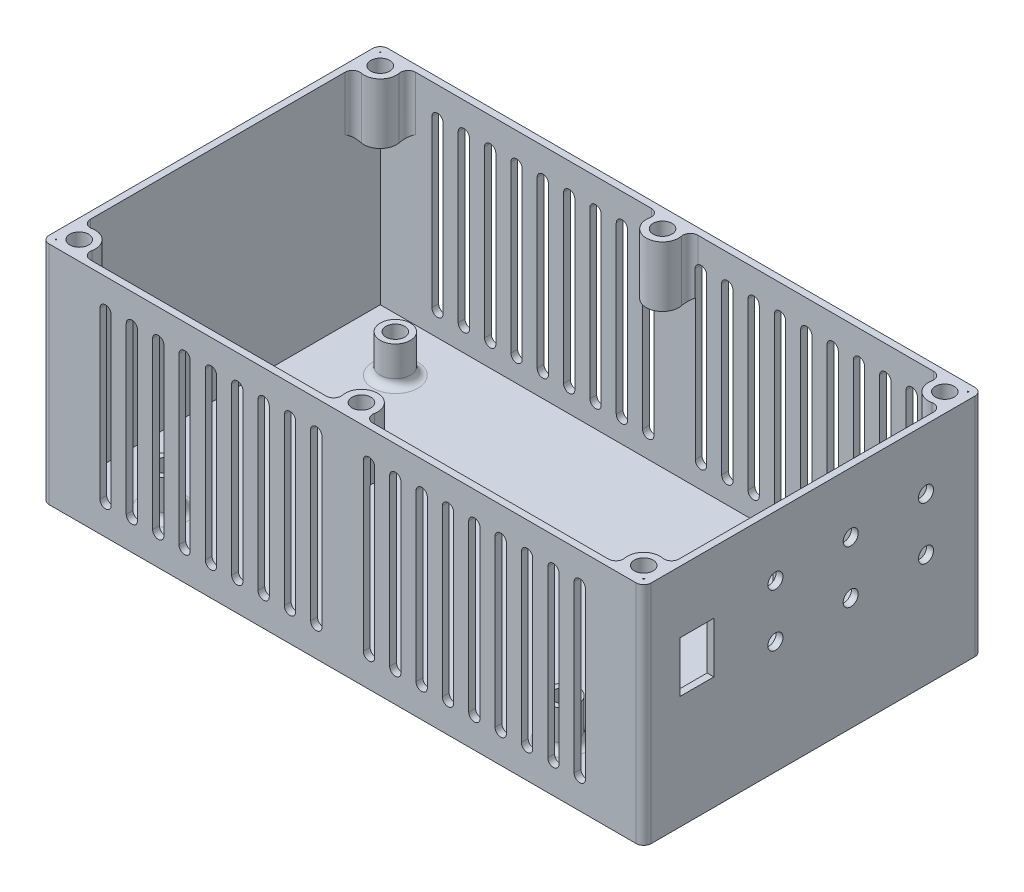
SolidWorks part; units mm, degrees
ref_plane "Front Plane" through (0, 0, 0) normal (0, 0, 1) x (1, 0, 0)
ref_plane "Top Plane" through (0, 0, 0) normal (0, 1, 0) x (1, 0, 0)
ref_plane "Right Plane" through (0, 0, 0) normal (1, 0, 0) x (0, 0, -1)
sketch "Sketch1" plane through (0, 0, 0) normal (0, 1, 0) x (1, 0, 0)
  line L1 (-80, -45) -> (80, -45)
  line L2 (-80, -45) -> (-80, 45)
  line L3 (-80, 45) -> (80, 45)
  line L4 (80, -45) -> (80, 45)
  line L5 (-80, -45) -> (80, 45) construction
  line L6 (-80, 45) -> (80, -45) construction
  point P0 (0, 0)
  dimension "D1" = 160
  dimension "D2" = 90
extrude "Boss-Extrude1" add sketch "Sketch1" along normal blind 60
sketch "Sketch2" plane through (0, 60, 0) normal (0, 1, 0) x (1, 0, 0)
  line L0 (80, 45) -> (-80, 45) construction
  line L1 (-80, 45) -> (-80, -45) construction
  line L2 (80, -45) -> (80, 45) construction
  line L3 (-80, -45) -> (80, -45) construction
  point P0 (-75, 40)
  point P1 (75, 40)
  point P2 (75, -40)
  point P3 (-75, -40)
  point P4 (0, -40)
  point P5 (0, 40)
  dimension "D1" = 5
  dimension "D2" = 5
  dimension "D3" = 5
  dimension "D4" = 5
  dimension "D5" = 5
  dimension "D6" = 5
  dimension "D7" = 5
  dimension "D8" = 5
  dimension "D9" = 5
  dimension "D10" = 5
  dimension "D11" = 80
  dimension "D12" = 80
hole_wizard "Ø4.0mm Dowel Hole1" positions "Sketch3" profile "Sketch5" hole size "Ø4.0" standard "ANSI Metric"
sketch "Sketch3" plane through (0, 60, 0) normal (0, 1, 0) x (1, 0, 0)
  point P0 (-75, 40)
  point P3 (0, 40)
  point P6 (75, 40)
  point P9 (75, -40)
  point P12 (0, -40)
  point P15 (-75, -40)
sketch "Sketch5" plane through (-75, 60, -40) normal (1, 0, 0) x (0, 0, 1)
  line L0 (0, 0) -> (0, 16.5022)
  line L1 (0, 16.5022) -> (2.5, 15)
  line L2 (2.5, 15) -> (2.5, 0)
  line L5 (2.5, 0) -> (0, 0)
  line L10 (0, 16.5022) -> (-2.5, 15) construction
  line L11 (0, -6.35) -> (0, 107.95) construction
  dimension "Hole Dia." = 5
  dimension "Hole Depth" = 15
  dimension "Drill Angle" = 118
shell "Shell1" thickness 1.8
sketch "Sketch7" plane through (0, 0, 45) normal (0, 0, 1) x (1, 0, 0)
  line L3 (-63, 51.9835) -> (-63, 8.0165) construction
  line L6 (-61.5, 51.9835) -> (-61.5, 8.0165)
  line L9 (-64.5, 51.9835) -> (-64.5, 8.0165)
  line L12 (-56, 51.9835) -> (-56, 8.0165) construction
  line L15 (-54.5, 51.9835) -> (-54.5, 8.0165)
  line L18 (-57.5, 51.9835) -> (-57.5, 8.0165)
  line L21 (-49, 51.9835) -> (-49, 8.0165) construction
  line L24 (-47.5, 51.9835) -> (-47.5, 8.0165)
  line L27 (-50.5, 51.9835) -> (-50.5, 8.0165)
  line L30 (-42, 51.9835) -> (-42, 8.0165) construction
  line L33 (-40.5, 51.9835) -> (-40.5, 8.0165)
  line L36 (-43.5, 51.9835) -> (-43.5, 8.0165)
  line L39 (-35, 51.9835) -> (-35, 8.0165) construction
  line L42 (-33.5, 51.9835) -> (-33.5, 8.0165)
  line L48 (-36.5, 51.9835) -> (-36.5, 8.0165)
  line L49 (-28, 51.9835) -> (-28, 8.0165) construction
  line L50 (-26.5, 51.9835) -> (-26.5, 8.0165)
  line L51 (-29.5, 51.9835) -> (-29.5, 8.0165)
  line L52 (-21, 51.9835) -> (-21, 8.0165) construction
  line L53 (-19.5, 51.9835) -> (-19.5, 8.0165)
  line L54 (-22.5, 51.9835) -> (-22.5, 8.0165)
  line L55 (-14, 51.9835) -> (-14, 8.0165) construction
  line L56 (-12.5, 51.9835) -> (-12.5, 8.0165)
  line L57 (-15.5, 51.9835) -> (-15.5, 8.0165)
  line L58 (-7, 51.9835) -> (-7, 8.0165) construction
  line L59 (-5.5, 51.9835) -> (-5.5, 8.0165)
  line L60 (-8.5, 51.9835) -> (-8.5, 8.0165)
  line L64 (7, 51.9835) -> (7, 8.0165) construction
  line L65 (8.5, 51.9835) -> (8.5, 8.0165)
  line L66 (5.5, 51.9835) -> (5.5, 8.0165)
  line L67 (14, 51.9835) -> (14, 8.0165) construction
  line L68 (15.5, 51.9835) -> (15.5, 8.0165)
  line L69 (12.5, 51.9835) -> (12.5, 8.0165)
  line L70 (21, 51.9835) -> (21, 8.0165) construction
  line L71 (22.5, 51.9835) -> (22.5, 8.0165)
  line L72 (19.5, 51.9835) -> (19.5, 8.0165)
  line L73 (28, 51.9835) -> (28, 8.0165) construction
  line L74 (29.5, 51.9835) -> (29.5, 8.0165)
  line L75 (26.5, 51.9835) -> (26.5, 8.0165)
  line L76 (35, 51.9835) -> (35, 8.0165) construction
  line L77 (36.5, 51.9835) -> (36.5, 8.0165)
  line L78 (33.5, 51.9835) -> (33.5, 8.0165)
  line L79 (42, 51.9835) -> (42, 8.0165) construction
  line L80 (43.5, 51.9835) -> (43.5, 8.0165)
  line L81 (40.5, 51.9835) -> (40.5, 8.0165)
  line L82 (49, 51.9835) -> (49, 8.0165) construction
  line L83 (50.5, 51.9835) -> (50.5, 8.0165)
  line L84 (47.5, 51.9835) -> (47.5, 8.0165)
  line L85 (56, 51.9835) -> (56, 8.0165) construction
  line L86 (57.5, 51.9835) -> (57.5, 8.0165)
  line L87 (54.5, 51.9835) -> (54.5, 8.0165)
  line L88 (63, 51.9835) -> (63, 8.0165) construction
  line L89 (64.5, 51.9835) -> (64.5, 8.0165)
  line L90 (61.5, 51.9835) -> (61.5, 8.0165)
  arc A30 (-61.5, 51.9835) -> (-64.5, 51.9835) centre (-63, 51.9835) ccw
  arc A31 (-64.5, 8.0165) -> (-61.5, 8.0165) centre (-63, 8.0165) ccw
  arc A32 (-54.5, 51.9835) -> (-57.5, 51.9835) centre (-56, 51.9835) ccw
  arc A33 (-57.5, 8.0165) -> (-54.5, 8.0165) centre (-56, 8.0165) ccw
  arc A34 (-47.5, 51.9835) -> (-50.5, 51.9835) centre (-49, 51.9835) ccw
  arc A35 (-50.5, 8.0165) -> (-47.5, 8.0165) centre (-49, 8.0165) ccw
  arc A36 (-40.5, 51.9835) -> (-43.5, 51.9835) centre (-42, 51.9835) ccw
  arc A37 (-43.5, 8.0165) -> (-40.5, 8.0165) centre (-42, 8.0165) ccw
  arc A38 (-33.5, 51.9835) -> (-36.5, 51.9835) centre (-35, 51.9835) ccw
  arc A39 (-36.5, 8.0165) -> (-33.5, 8.0165) centre (-35, 8.0165) ccw
  arc A40 (-26.5, 51.9835) -> (-29.5, 51.9835) centre (-28, 51.9835) ccw
  arc A41 (-29.5, 8.0165) -> (-26.5, 8.0165) centre (-28, 8.0165) ccw
  arc A42 (-19.5, 51.9835) -> (-22.5, 51.9835) centre (-21, 51.9835) ccw
  arc A43 (-22.5, 8.0165) -> (-19.5, 8.0165) centre (-21, 8.0165) ccw
  arc A44 (-12.5, 51.9835) -> (-15.5, 51.9835) centre (-14, 51.9835) ccw
  arc A45 (-15.5, 8.0165) -> (-12.5, 8.0165) centre (-14, 8.0165) ccw
  arc A46 (-5.5, 51.9835) -> (-8.5, 51.9835) centre (-7, 51.9835) ccw
  arc A47 (-8.5, 8.0165) -> (-5.5, 8.0165) centre (-7, 8.0165) ccw
  arc A50 (8.5, 51.9835) -> (5.5, 51.9835) centre (7, 51.9835) ccw
  arc A51 (5.5, 8.0165) -> (8.5, 8.0165) centre (7, 8.0165) ccw
  arc A52 (15.5, 51.9835) -> (12.5, 51.9835) centre (14, 51.9835) ccw
  arc A53 (12.5, 8.0165) -> (15.5, 8.0165) centre (14, 8.0165) ccw
  arc A54 (22.5, 51.9835) -> (19.5, 51.9835) centre (21, 51.9835) ccw
  arc A55 (19.5, 8.0165) -> (22.5, 8.0165) centre (21, 8.0165) ccw
  arc A56 (29.5, 51.9835) -> (26.5, 51.9835) centre (28, 51.9835) ccw
  arc A57 (26.5, 8.0165) -> (29.5, 8.0165) centre (28, 8.0165) ccw
  arc A58 (36.5, 51.9835) -> (33.5, 51.9835) centre (35, 51.9835) ccw
  arc A59 (33.5, 8.0165) -> (36.5, 8.0165) centre (35, 8.0165) ccw
  arc A60 (43.5, 51.9835) -> (40.5, 51.9835) centre (42, 51.9835) ccw
  arc A61 (40.5, 8.0165) -> (43.5, 8.0165) centre (42, 8.0165) ccw
  arc A62 (50.5, 51.9835) -> (47.5, 51.9835) centre (49, 51.9835) ccw
  arc A63 (47.5, 8.0165) -> (50.5, 8.0165) centre (49, 8.0165) ccw
  arc A64 (57.5, 51.9835) -> (54.5, 51.9835) centre (56, 51.9835) ccw
  arc A65 (54.5, 8.0165) -> (57.5, 8.0165) centre (56, 8.0165) ccw
  arc A66 (64.5, 51.9835) -> (61.5, 51.9835) centre (63, 51.9835) ccw
  arc A67 (61.5, 8.0165) -> (64.5, 8.0165) centre (63, 8.0165) ccw
  point P12 (-63, 30)
  point P19 (-56, 30)
  point P26 (-49, 30)
  point P33 (-42, 30)
  point P40 (-35, 30)
  point P47 (-28, 30)
  point P54 (-21, 30)
  point P61 (-14, 30)
  point P68 (-7, 30)
  point P82 (7, 30)
  point P89 (14, 30)
  point P96 (21, 30)
  point P103 (28, 30)
  point P112 (35, 30)
  point P119 (42, 30)
  point P126 (49, 30)
  point P133 (56, 30)
  point P140 (63, 30)
  point P153 (0, 30)
extrude "Cut-Extrude1" cut sketch "Sketch7" against normal blind 100
sketch "Sketch8" plane through (80, 0, 0) normal (1, 0, 0) x (0, 0, -1)
  line L0 (-45, 60) -> (45, 60) construction
  line L2 (-45, 60) -> (-45, 0) construction
  circle A0 centre (-10, 44) radius 2
  circle A3 centre (-10, 30) radius 2
  circle A4 centre (10, 44) radius 2
  circle A5 centre (30, 44) radius 2
  circle A6 centre (10, 30) radius 2
  circle A7 centre (30, 30) radius 2
  dimension "D2" = 4
  dimension "D4" = 4
  dimension "D5" = 16
  dimension "D6" = 35
  dimension "D7" = 35
  dimension "D8" = 30
  dimension "D1" = 3
  dimension "D3" = 3
extrude "Cut-Extrude2" cut sketch "Sketch8" against normal blind 50
sketch "Sketch9" plane through (0, 1.8, 0) normal (0, 1, 0) x (1, 0, 0)
  line L0 (-80, 45) -> (-80, -45) construction
  line L1 (80, 45) -> (-80, 45) construction
  circle A0 centre (-60, 29) radius 4
  circle A1 centre (-60, -32.5) radius 4
  circle A2 centre (46, 29) radius 4
  circle A3 centre (46, -32.5) radius 4
  circle A4 centre (-60, 29) radius 2.5
  circle A5 centre (46, 29) radius 2.5
  circle A6 centre (-60, -32.5) radius 2.5
  circle A7 centre (46, -32.5) radius 2.5
  dimension "D8" = 8
  dimension "D9" = 8
  dimension "D10" = 8
  dimension "D11" = 8
  dimension "D13" = 5
  dimension "D14" = 5
  dimension "D15" = 5
  dimension "D16" = 5
  dimension "D1" = 106
  dimension "D2" = 106
  dimension "D3" = 61.5
  dimension "D4" = 61.5
  dimension "D5" = 20
  dimension "D6" = 20
  dimension "D7" = 16
  dimension "D12" = 16
extrude "Boss-Extrude2" add sketch "Sketch9" along normal blind 10
fillet "Fillet1" radius 2 4 edges at (46, 1.8, 28.5) (-60, 1.8, 28.5) (46, 1.8, -33) (-60, 1.8, -33)
fillet "Fillet2" radius 2 12 edges at (78.2, 51.9908, -37.1277) (78.2, 51.9908, 37.1277) (72.1277, 51.9908, 43.2) (2.8723, 51.9908, 43.2) (-2.8723, 51.9908, 43.2) (-78.2, 51.9908, 37.1277) (-72.1277, 51.9908, 43.2) (-78.2, 51.9908, -37.1277) (-72.1277, 51.9908, -43.2) (72.1277, 51.9908, -43.2) (2.8723, 51.9908, -43.2) (-2.8723, 51.9908, -43.2)
fillet "Fillet3" radius 2 4 edges at (80, 30, 45) (-80, 30, 45) (-80, 30, -45) (80, 30, -45)
sketch "Sketch11" plane through (80, 0, 0) normal (1, 0, 0) x (0, 0, -1)
  line L1 (-35.3614, 43.5473) -> (-26.3614, 43.5473)
  line L2 (-35.3614, 43.5473) -> (-35.3614, 30.0473)
  line L3 (-35.3614, 30.0473) -> (-26.3614, 30.0473)
  line L4 (-26.3614, 43.5473) -> (-26.3614, 30.0473)
  dimension "D1" = 13.5
  dimension "D2" = 9
extrude "Cut-Extrude3" cut sketch "Sketch11" against normal blind 10
